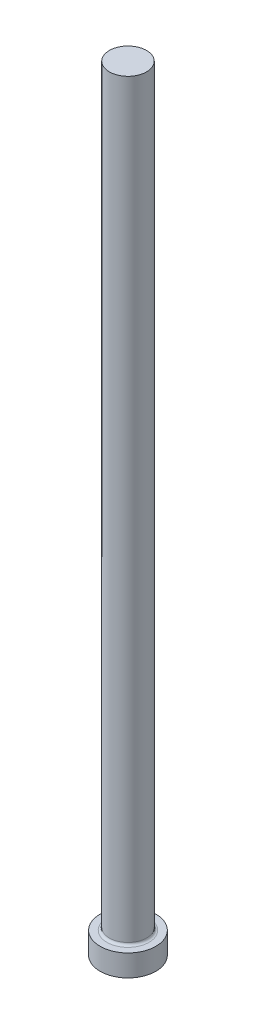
SolidWorks part; units mm, degrees
ref_plane "Plano frontal" through (0, 0, 0) normal (0, 0, 1) x (1, 0, 0)
ref_plane "Plano superior" through (0, 0, 0) normal (0, 1, 0) x (1, 0, 0)
ref_plane "Plano direito" through (0, 0, 0) normal (1, 0, 0) x (0, 0, -1)
sketch "Esboço1" plane through (0, 0, 0) normal (0, 0, 1) x (1, 0, 0)
  line L0 (0, 0) -> (9, 0)
  line L1 (9, 0) -> (9, 7)
  line L2 (9, 7) -> (6.8, 7)
  line L3 (6, 7.8) -> (6, 250)
  line L4 (6, 250) -> (0, 250)
  line L5 (0, 250) -> (0, 0) construction
  line L6 (0, 0) -> (0, 250)
  arc A0 (6.8, 7) -> (6, 7.8) centre (6.8, 7.8) cw
  dimension "D3" = 0.8
  dimension "D1" = 18
  dimension "D2" = 12
  dimension "D4" = 7
  dimension "D5" = 250
revolve "Revolução1" add sketch "Esboço1" angle 360 about L5
sketch "Esboço2"
  dimension "D1" = 1.0125
  dimension "D2" = 1.575
  dimension "D3" = 0.675
  dimension "D4" = 4.8375
wrap "Envolver1" sketch "Esboço2" wrap type deboss source sketch "Esboço2" thickness 0.1 parameters "D1"=0.1
